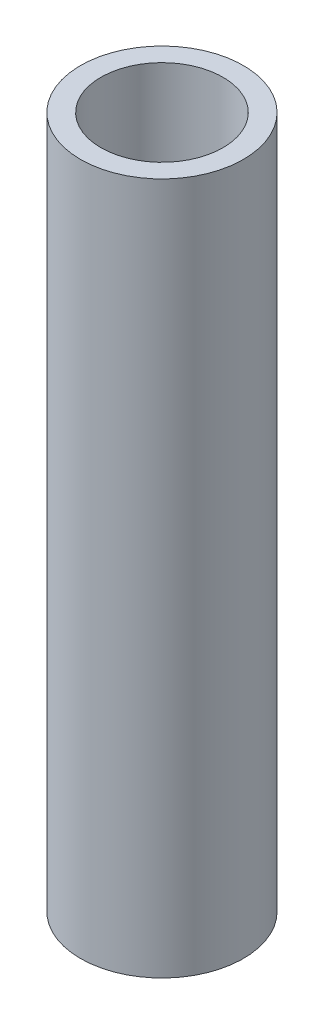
SolidWorks part; units mm, degrees
ref_plane "前视基准面" through (0, 0, 0) normal (0, 0, 1) x (1, 0, 0)
ref_plane "上视基准面" through (0, 0, 0) normal (0, 1, 0) x (1, 0, 0)
ref_plane "右视基准面" through (0, 0, 0) normal (1, 0, 0) x (0, 0, -1)
sketch "草图1" plane through (0, 0, 0) normal (0, 1, 0) x (1, 0, 0)
  circle A0 centre (0, 0) radius 12
  circle A1 centre (0, 0) radius 9
  dimension "D1" = 24
  dimension "D2" = 18
extrude "凸台-拉伸1" add sketch "草图1" along normal mid plane 102
